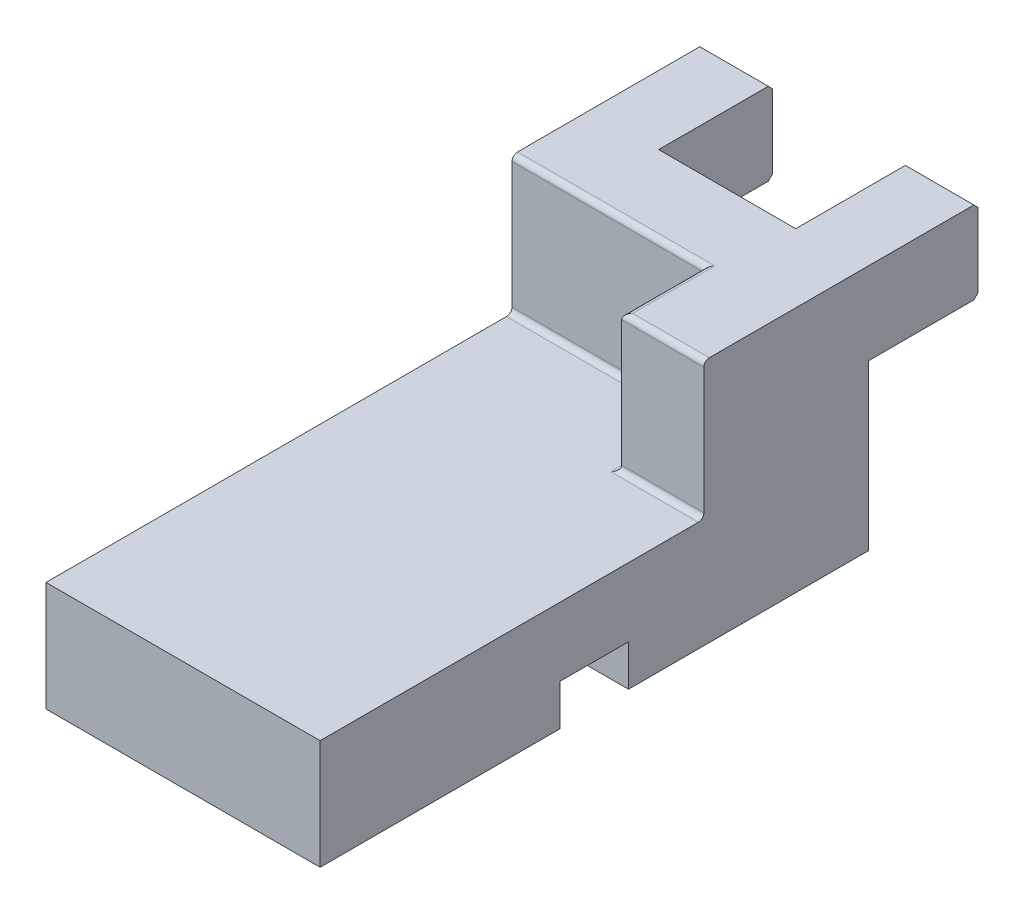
SolidWorks part; units mm, degrees
ref_plane "Ebene vorne" through (0, 0, 0) normal (0, 0, 1) x (1, 0, 0)
ref_plane "Ebene oben" through (0, 0, 0) normal (0, 1, 0) x (1, 0, 0)
ref_plane "Ebene rechts" through (0, 0, 0) normal (1, 0, 0) x (0, 0, -1)
sketch "Skizze1" plane through (0, 0, 0) normal (1, 0, 0) x (0, 0, -1)
  line L1 (-100, 20) -> (100, 20)
  line L2 (-100, 20) -> (-100, -20)
  line L3 (-100, -20) -> (100, -20)
  line L4 (100, 20) -> (100, -20)
  line L5 (-100, 20) -> (100, -20) construction
  line L6 (-100, -20) -> (100, 20) construction
  point P0 (0, 0)
  dimension "D1" = 200
  dimension "D2" = 40
extrude "Aufsatz-Linear austragen1" add sketch "Skizze1" along normal mid plane 100
sketch "Skizze2" plane through (50, 0, 0) normal (1, 0, 0) x (0, 0, -1)
  line L0 (-100, -20) -> (100, -20) construction
  line L1 (-12.5, -20) -> (12.5, -20)
  line L2 (-12.5, -20) -> (-12.5, -5)
  line L3 (-12.5, -5) -> (12.5, -5)
  line L4 (12.5, -20) -> (12.5, -5)
  line L5 (-100, 20) -> (-100, -20) construction
  dimension "D1" = 25
  dimension "D2" = 15
  dimension "D3" = 87.5
extrude "Schnitt-Linear austragen1" cut sketch "Skizze2" against normal through all
sketch "Skizze3" plane through (0, 20, 0) normal (0, 1, 0) x (1, 0, 0)
  line L0 (50, 100) -> (50, 40)
  line L1 (50, 100) -> (50, -100) construction
  line L2 (50, 40) -> (20, 40)
  line L3 (20, 40) -> (20, 70)
  line L4 (20, 70) -> (-50, 70)
  line L5 (-50, 100) -> (-50, -100) construction
  line L6 (-50, 70) -> (-50, 100)
  line L7 (-50, 100) -> (50, 100)
  dimension "D1" = 30
  dimension "D2" = 30
  dimension "D3" = 30
extrude "Aufsatz-Linear austragen2" add sketch "Skizze3" along normal blind 50
sketch "Skizze4" plane through (0, 0, -100) normal (0, 0, -1) x (-1, 0, 0)
  line L1 (-50, 70) -> (-25, 70)
  line L2 (-50, 70) -> (-50, 40)
  line L3 (-50, 40) -> (-25, 40)
  line L4 (-25, 70) -> (-25, 40)
  line L5 (50, 70) -> (25, 70)
  line L6 (50, 70) -> (50, 40)
  line L7 (50, 40) -> (25, 40)
  line L8 (25, 70) -> (25, 40)
  dimension "D1" = 25
  dimension "D2" = 30
extrude "Aufsatz-Linear austragen3" add sketch "Skizze4" along normal blind 40
fillet "Verrundung1" radius 2 3 edges at (35, 20, -40) (20, 20, -55) (-15, 20, -70)
fillet "Verrundung2" radius 2 3 edges at (35, 70, -40) (20, 70, -55) (-15, 70, -70)
chamfer "Fase1" distance 1.5 angle 45 5 edges at (0, 70, -100) (37.5, 40, -140) (37.5, 70, -140) (-37.5, 40, -140) (-37.5, 70, -140)
